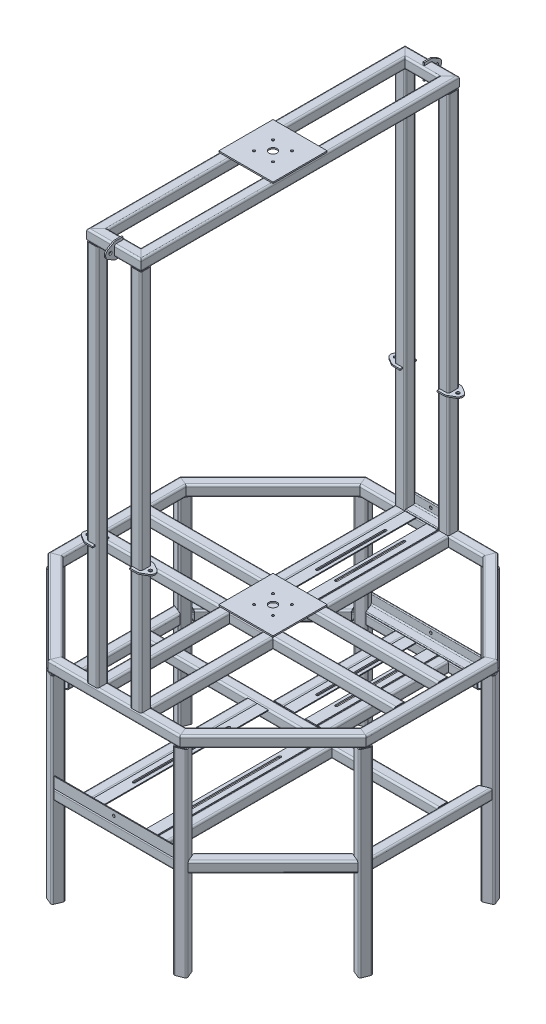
SolidWorks part; units mm, degrees
other "Markup1"
sketch "Sketch22" plane through (591.5094, 1475, 615.7908) normal (0.2707, 0.9524, 0.1401) x (0.5233, -0.0234, -0.8518)
ref_plane "Front Plane" through (0, 0, 0) normal (0, 0, 1) x (1, 0, 0)
ref_plane "Top Plane" through (0, 0, 0) normal (0, 1, 0) x (1, 0, 0)
ref_plane "Right Plane" through (0, 0, 0) normal (1, 0, 0) x (0, 0, -1)
sketch "Sketch2" plane through (0, 0, 0) normal (0, 1, 0) x (1, 0, 0)
  line L1 (567.3402, 235) -> (235, 567.3402)
  line L2 (235, 567.3402) -> (-235, 567.3402)
  line L3 (-235, 567.3402) -> (-567.3402, 235)
  line L4 (-567.3402, 235) -> (-567.3402, -235)
  line L5 (-567.3402, -235) -> (-235, -567.3402)
  line L6 (-235, -567.3402) -> (235, -567.3402)
  line L7 (235, -567.3402) -> (567.3402, -235)
  line L8 (567.3402, -235) -> (567.3402, 235)
  circle A0 centre (0, 0) radius 567.3402 construction
  dimension "D1" = 470
sketch3d "3DSketch1"
  line L0 (-567.3402, 0, 235) -> (-567.3402, -750, 235)
  line L1 (-235, 0, 567.3402) -> (-235, -750, 567.3402)
  line L2 (235, 0, 567.3402) -> (235, -750, 567.3402)
  line L3 (567.3402, 0, 235) -> (567.3402, -750, 235)
  line L4 (567.3402, 0, -235) -> (567.3402, -750, -235)
  line L5 (235, 0, -567.3402) -> (235, -750, -567.3402)
  line L6 (-235, 0, -567.3402) -> (-235, -750, -567.3402)
  line L7 (-567.3402, 0, -235) -> (-567.3402, -750, -235)
  dimension "D1" = 750
  dimension "D2" = 750
  dimension "D3" = 750
  dimension "D4" = 750
  dimension "D5" = 750
  dimension "D6" = 750
  dimension "D7" = 750
  dimension "D8" = 750
sketch3d "3DSketch3"
  line L0 (235, -400, -567.3402) -> (-235, -400, -567.3402)
  line L1 (235, 0, -567.3402) -> (235, -750, -567.3402) construction
  line L2 (-235, 0, -567.3402) -> (-235, -750, -567.3402) construction
  line L3 (-235, -400, -567.3402) -> (-567.3402, -400, -235)
  line L4 (-567.3402, 0, -235) -> (-567.3402, -750, -235) construction
  line L5 (-567.3402, -400, -235) -> (-567.3402, -400, 235)
  line L6 (-567.3402, 0, 235) -> (-567.3402, -750, 235) construction
  line L7 (-567.3402, -400, 235) -> (-235, -400, 567.3402)
  line L8 (-235, 0, 567.3402) -> (-235, -750, 567.3402) construction
  line L9 (-235, -400, 567.3402) -> (235, -400, 567.3402)
  line L10 (235, 0, 567.3402) -> (235, -750, 567.3402) construction
  line L11 (235, -400, 567.3402) -> (567.3402, -400, 235)
  line L12 (567.3402, 0, 235) -> (567.3402, -750, 235) construction
  line L13 (567.3402, -400, 235) -> (567.3402, -400, -235)
  line L14 (567.3402, 0, -235) -> (567.3402, -750, -235) construction
  line L15 (567.3402, -400, -235) -> (235, -400, -567.3402)
  line L16 (567.3402, 0, 0) -> (-567.3402, 0, 0) construction
  line L17 (567.3402, 0, 235) -> (567.3402, 0, -235) construction
  line L18 (-567.3402, 0, -235) -> (-567.3402, 0, 235) construction
  line L19 (567.3402, 0, 60) -> (-567.3402, 0, 60)
  line L20 (567.3402, 0, -60) -> (-567.3402, 0, -60)
  line L21 (0, 0, 567.3402) -> (0, 0, -567.3402) construction
  line L22 (-235, 0, 567.3402) -> (235, 0, 567.3402) construction
  line L23 (60, 0, -567.3402) -> (60, 0, -60)
  line L24 (235, 0, -567.3402) -> (-235, 0, -567.3402) construction
  line L25 (-60, 0, 567.3402) -> (-60, 0, 60)
  line L27 (-117.5, -400, -60) -> (-117.5, -400, 567.3402)
  line L28 (-60, -400, -60) -> (-60, -400, -567.3402)
  line L29 (117.5, -400, -60) -> (117.5, -400, 567.3402)
  line L30 (-235, -380, 567.3402) -> (235, -380, 567.3402)
  line L31 (567.3402, -400, -60) -> (-567.3402, -400, -60)
  line L32 (60, -400, -60) -> (60, -400, -567.3402)
  line L33 (-60, 0, -60) -> (-60, 0, -567.3402)
  line L34 (60, 0, 60) -> (60, 0, 567.3402)
  point P59 (0, -400, 567.3402)
  point P60 (0, -400, -60)
sketch3d "3DSketch6"
  line L0 (60, 0, -567.3402) -> (60, 1450, -567.3402)
  line L1 (-60, 0, -567.3402) -> (-60, 1450, -567.3402)
  line L2 (60, 0, 567.3402) -> (60, 1450, 567.3402)
  line L3 (-60, 0, 567.3402) -> (-60, 1450, 567.3402)
  line L4 (60, 1450, -567.3402) -> (60, 1450, 567.3402)
  line L5 (-60, 1450, 567.3402) -> (-60, 1450, -567.3402)
  line L6 (60, 1450, -567.3402) -> (-60, 1450, -567.3402)
  line L7 (-60, 1450, 567.3402) -> (60, 1450, 567.3402)
  line L8 (60, 20, -567.3402) -> (-60, 20, -567.3402)
  dimension "D1" = 1450
  dimension "D2" = 1450
  dimension "D3" = 1450
  dimension "D4" = 1450
  dimension "D5" = 20
other "Tube (square) 40 X 40 X 3.2(13)"
ref_plane "Plane16" through (-235, 0, -567.3402) normal (-0.7071, 0, 0.7071) x (0.7071, 0, 0.7071)
sketch "Sketch1" plane through (-235, 0, -567.3402) normal (-0.7071, 0, 0.7071) x (0.7071, 0, 0.7071)
  line L0 (-13.6, -16.8) -> (13.6, -16.8)
  line L1 (-16.8, -13.6) -> (-16.8, 13.6)
  line L2 (13.6, 16.8) -> (-13.6, 16.8)
  line L3 (16.8, 13.6) -> (16.8, -13.6)
  line L4 (-13.6, -20) -> (13.6, -20)
  line L5 (-20, -13.6) -> (-20, 13.6)
  line L6 (13.6, 20) -> (-13.6, 20)
  line L7 (20, 13.6) -> (20, -13.6)
  line L8 (-20, 0) -> (-16.8, 0) construction
  line L9 (-16.8, 0) -> (16.8, 0) construction
  line L10 (16.8, 0) -> (20, 0) construction
  line L12 (0, 20) -> (0, 16.8) construction
  line L13 (0, 16.8) -> (0, -16.8) construction
  line L14 (0, -16.8) -> (0, -20) construction
  arc A0 (20, 13.6) -> (13.6, 20) centre (13.6, 13.6) ccw
  arc A1 (13.6, -20) -> (20, -13.6) centre (13.6, -13.6) ccw
  arc A2 (-20, -13.6) -> (-13.6, -20) centre (-13.6, -13.6) ccw
  arc A3 (-13.6, 20) -> (-20, 13.6) centre (-13.6, 13.6) ccw
  arc A4 (-13.6, 16.8) -> (-16.8, 13.6) centre (-13.6, 13.6) ccw
  arc A5 (16.8, 13.6) -> (13.6, 16.8) centre (13.6, 13.6) ccw
  arc A6 (13.6, -16.8) -> (16.8, -13.6) centre (13.6, -13.6) ccw
  arc A7 (-16.8, -13.6) -> (-13.6, -16.8) centre (-13.6, -13.6) ccw
  point P2 (-20, 20)
  point P33 (-20, -20)
  point P34 (20, -20)
  point P36 (20, 20)
  point P37 (0, 0)
  dimension "D1" = 6.4
  dimension "Thickness" = 3.2
  dimension "V_leg" = 40
  dimension "H_leg" = 40
sketch "Sketch3" plane through (0, 1470, 0) normal (0, 1, 0) x (1, 0, 0)
  line L1 (-100, 100) -> (100, 100)
  line L2 (-100, 100) -> (-100, -100)
  line L3 (-100, -100) -> (100, -100)
  line L4 (100, 100) -> (100, -100)
  line L5 (0, -100) -> (0, 100) construction
  line L6 (-100, 0) -> (100, 0) construction
  line L8 (-35, -35) -> (35, -35) construction
  line L9 (-35, -35) -> (-35, 35) construction
  line L10 (-35, 35) -> (35, 35) construction
  line L11 (35, -35) -> (35, 35) construction
  line L12 (0, 35) -> (0, -35) construction
  line L13 (-35, 0) -> (35, 0) construction
  circle A0 centre (0, 0) radius 15
  circle A1 centre (-35, 35) radius 4.5
  circle A2 centre (35, 35) radius 4.5
  circle A3 centre (35, -35) radius 4.5
  circle A4 centre (-35, -35) radius 4.5
  point P0 (0, 0)
  dimension "D2" = 9
  dimension "D5" = 30
  dimension "D1" = 200
  dimension "D3" = 70
  dimension "D4" = 70
other "Trim/Extend1"
other "Trim/Extend2"
other "Trim/Extend3"
other "Trim/Extend4"
extrude "Boss-Extrude2" add sketch "Sketch3" along normal blind 5 separate body
sketch "Sketch4" plane through (0, 20, 0) normal (0, 1, 0) x (1, 0, 0)
  line L4 (100, -100) -> (100, 100)
  line L5 (100, 100) -> (-100, 100)
  line L6 (-100, 100) -> (-100, -100)
  line L7 (-100, -100) -> (100, -100)
  line L8 (100, -100) -> (100, 100)
  line L9 (100, 100) -> (-100, 100)
  line L10 (-100, 100) -> (-100, -100)
  line L11 (-100, -100) -> (100, -100)
  circle A0 centre (-35, 35) radius 4.5 construction
  circle A1 centre (-35, -35) radius 4.5 construction
  circle A2 centre (35, -35) radius 4.5 construction
  circle A3 centre (35, 35) radius 4.5 construction
  circle A4 centre (0, 0) radius 15 construction
  circle A5 centre (-35, 35) radius 4.5
  circle A6 centre (-35, -35) radius 4.5
  circle A7 centre (35, -35) radius 4.5
  circle A8 centre (35, 35) radius 4.5
  circle A9 centre (0, 0) radius 15
  dimension "D1" = 0
extrude "Boss-Extrude3" add sketch "Sketch4" along normal blind 5 separate body
other "L angle (equal) 40 X 40 X 5(18)"
ref_plane "Plane17" through (117.5, -380, -60) normal (0, 0, 1) x (-1, 0, 0)
sketch "Sketch11" plane through (117.5, -380, -60) normal (0, 0, 1) x (-1, 0, 0)
  line L0 (0, 40) -> (0, 0)
  line L2 (5, 37) -> (5, 9.5)
  line L3 (9.5, 5) -> (37, 5)
  line L5 (40, 0) -> (0, 0)
  line L6 (40, 2) -> (40, 0)
  line L7 (0, 40) -> (2, 40)
  arc A0 (2, 40) -> (5, 37) centre (2, 37) cw
  arc A1 (40, 2) -> (37, 5) centre (37, 2) ccw
  arc A2 (9.5, 5) -> (5, 9.5) centre (9.5, 9.5) cw
  point P10 (0, 20)
  point P11 (20, 0)
  point P14 (0, 0)
  dimension "Radius_2" = 3
  dimension "Radius_1" = 4.5
  dimension "V_leg" = 40
  dimension "H_leg" = 40
  dimension "thickness" = 5
other "Trim/Extend5"
other "Trim/Extend6"
sketch "Sketch12" plane through (0, -380, 0) normal (0, 1, 0) x (1, 0, 0)
  line L0 (94.25, 60) -> (94.25, -547.3402) construction
  line L1 (108, 60) -> (80.5, 60) construction
  line L2 (80.5, -547.3402) -> (108, -547.3402) construction
  line L3 (94.25, -68.6701) -> (94.25, -418.6701) construction
  line L4 (98.75, -68.6701) -> (98.75, -418.6701)
  line L5 (89.75, -68.6701) -> (89.75, -418.6701)
  line L6 (0, -677.3699) -> (0, 677.3699) construction
  line L7 (-94.25, -68.6701) -> (-94.25, -418.6701) construction
  line L8 (-98.75, -68.6701) -> (-98.75, -418.6701)
  line L9 (-89.75, -68.6701) -> (-89.75, -418.6701)
  arc A0 (98.75, -68.6701) -> (89.75, -68.6701) centre (94.25, -68.6701) ccw
  arc A1 (89.75, -418.6701) -> (98.75, -418.6701) centre (94.25, -418.6701) ccw
  arc A2 (-98.75, -68.6701) -> (-89.75, -68.6701) centre (-94.25, -68.6701) cw
  arc A3 (-89.75, -418.6701) -> (-98.75, -418.6701) centre (-94.25, -418.6701) cw
  point P8 (94.25, -243.6701)
  point P17 (-94.25, -243.6701)
  dimension "D1" = 4.5
  dimension "D2" = 350
extrude "Cut-Extrude1" cut sketch "Sketch12" against normal blind 5
sketch "Sketch13" plane through (0, -380, 0) normal (0, 1, 0) x (1, 0, 0)
  line L0 (-35, 547.3402) -> (-35, 100) construction
  line L3 (-35, 448.6701) -> (-35, 198.6701) construction
  line L4 (-30.5, 448.6701) -> (-30.5, 198.6701)
  line L5 (-39.5, 448.6701) -> (-39.5, 198.6701)
  line L6 (0, -677.3699) -> (0, 677.3699) construction
  line L7 (35, 448.6701) -> (35, 198.6701) construction
  line L8 (30.5, 448.6701) -> (30.5, 198.6701)
  line L9 (39.5, 448.6701) -> (39.5, 198.6701)
  line L10 (-60, 100) -> (-20, 100) construction
  line L11 (-60, 547.3402) -> (-20, 547.3402) construction
  arc A0 (-30.5, 448.6701) -> (-39.5, 448.6701) centre (-35, 448.6701) ccw
  arc A1 (-39.5, 198.6701) -> (-30.5, 198.6701) centre (-35, 198.6701) ccw
  arc A2 (30.5, 448.6701) -> (39.5, 448.6701) centre (35, 448.6701) cw
  arc A3 (39.5, 198.6701) -> (30.5, 198.6701) centre (35, 198.6701) cw
  point P8 (-35, 323.6701)
  point P17 (35, 323.6701)
  dimension "D2" = 4.5
  dimension "D1" = 250
  dimension "D3" = 35
other "L angle (equal) 40 X 40 X 5(21)"
ref_plane "Plane18" through (-235, -380, 587.3402) normal (1, 0, 0) x (0, 0, -1)
sketch "Sketch14" plane through (-235, -380, 587.3402) normal (1, 0, 0) x (0, 0, -1)
  line L0 (0, 40) -> (0, 0)
  line L2 (5, 37) -> (5, 9.5)
  line L3 (9.5, 5) -> (37, 5)
  line L5 (40, 0) -> (0, 0)
  line L6 (40, 2) -> (40, 0)
  line L7 (0, 40) -> (2, 40)
  arc A0 (2, 40) -> (5, 37) centre (2, 37) cw
  arc A1 (40, 2) -> (37, 5) centre (37, 2) ccw
  arc A2 (9.5, 5) -> (5, 9.5) centre (9.5, 9.5) cw
  point P10 (0, 20)
  point P11 (20, 0)
  point P14 (0, 0)
  dimension "Radius_2" = 3
  dimension "Radius_1" = 4.5
  dimension "V_leg" = 40
  dimension "H_leg" = 40
  dimension "thickness" = 5
other "Trim/Extend7"
sketch "Sketch15" plane through (0, 0, 587.3402) normal (0, 0, 1) x (1, 0, 0)
  line L0 (221.6364, -380) -> (-221.6364, -380) construction
  line L3 (0, -340) -> (0, -380) construction
  line L4 (221.6364, -340) -> (-221.6364, -340) construction
  line L5 (-235, -380) -> (235, -380) construction
  circle A0 centre (0, -356.5) radius 5
  dimension "D1" = 10
  dimension "D2" = 23.5
extrude "Cut-Extrude3" cut sketch "Sketch15" against normal blind 5
mirror "Mirror1" about plane through (0, 0, 0) normal (0, 0, 1)
other "Trim/Extend8"
other "L angle (equal) 40 X 40 X 5(20)"
ref_plane "Plane19" through (60, 20, -587.3402) normal (-1, 0, 0) x (0, 0, 1)
sketch "Sketch19" plane through (60, 20, -587.3402) normal (-1, 0, 0) x (0, 0, 1)
  line L0 (0, 40) -> (0, 0)
  line L2 (5, 37) -> (5, 9.5)
  line L3 (9.5, 5) -> (37, 5)
  line L5 (40, 0) -> (0, 0)
  line L6 (40, 2) -> (40, 0)
  line L7 (0, 40) -> (2, 40)
  arc A0 (2, 40) -> (5, 37) centre (2, 37) cw
  arc A1 (40, 2) -> (37, 5) centre (37, 2) ccw
  arc A2 (9.5, 5) -> (5, 9.5) centre (9.5, 9.5) cw
  point P10 (0, 20)
  point P11 (20, 0)
  point P14 (0, 0)
  dimension "Radius_2" = 3
  dimension "Radius_1" = 4.5
  dimension "V_leg" = 40
  dimension "H_leg" = 40
  dimension "thickness" = 5
sketch "Sketch20" plane through (0, 0, -587.3402) normal (0, 0, -1) x (-1, 0, 0)
  line L0 (0, 60) -> (0, 20) construction
  line L1 (60, 60) -> (-60, 60) construction
  line L2 (60, 20) -> (-60, 20) construction
  circle A0 centre (0, 43.5) radius 5.1
  dimension "D1" = 10.2
  dimension "D2" = 23.5
extrude "Cut-Extrude5" cut sketch "Sketch20" against normal up to next
ref_plane "Plane20" through (0, 0, 0) normal (1, 0, 0) x (0, 0, -1)
sketch "Sketch21" plane through (0, 0, 0) normal (1, 0, 0) x (0, 0, -1)
  line L0 (587.3402, 1436.4) -> (587.3402, 1463.6) construction
  line L1 (587.3402, 1436.4) -> (587.3402, 1463.6)
  line L2 (580.9402, 1470) -> (555.9402, 1470)
  line L3 (-580.9402, 1470) -> (580.9402, 1470) construction
  line L4 (555.9402, 1470) -> (555.9402, 1480)
  line L5 (555.9402, 1480) -> (580.5812, 1480)
  line L6 (590.5812, 1477.3205) -> (611.2306, 1465.3986)
  line L7 (587.3402, 1450) -> (593.8896, 1450) construction
  line L8 (590.5812, 1422.6795) -> (611.2306, 1434.6014)
  line L9 (555.9402, 1420) -> (580.5812, 1420)
  line L10 (555.9402, 1430) -> (555.9402, 1420)
  line L11 (580.9402, 1430) -> (555.9402, 1430)
  arc A0 (580.9402, 1430) -> (587.3402, 1436.4) centre (580.9402, 1436.4) ccw construction
  arc A1 (587.3402, 1463.6) -> (580.9402, 1470) centre (580.9402, 1463.6) ccw construction
  arc A2 (580.9402, 1430) -> (587.3402, 1436.4) centre (580.9402, 1436.4) ccw
  arc A3 (587.3402, 1463.6) -> (580.9402, 1470) centre (580.9402, 1463.6) ccw
  arc A4 (611.2306, 1434.6014) -> (611.2306, 1465.3986) centre (602.3402, 1450) ccw
  circle A5 centre (602.3402, 1450) radius 6
  arc A6 (590.5812, 1422.6795) -> (580.5812, 1420) centre (580.5812, 1440) cw
  arc A7 (590.5812, 1477.3205) -> (580.5812, 1480) centre (580.5812, 1460) ccw
  point P14 (587.3402, 1450)
  point P22 (585.9402, 1420)
  point P26 (585.9402, 1480)
  dimension "D2" = 10
  dimension "D7" = 12
  dimension "D8" = 20
  dimension "D1" = 25
  dimension "D3" = 30
  dimension "D4" = 15
  dimension "D5" = 30
  dimension "D6" = 30
extrude "Boss-Extrude4" add sketch "Sketch21" along normal mid plane 5 separate body
move or copy body "Body-Move/Copy4" bodies to move or copy 438 copy yes number of copies 1 translate (0, 0, -97.3114)
move or copy body "Body-Move/Copy6" bodies to move or copy 449 placed by mates yes
other "Distance3" parameters "D1"=450
mirror "Mirror4" about plane through (0, 0, 0) normal (1, 0, 0)
mirror "Mirror5" about plane through (0, 0, 0) normal (0, 0, 1)
extrude "Cut-Extrude6" cut sketch "Sketch13" against normal through all both and the other way through all
other "Trim/Extend9"
other "Trim/Extend10"
other "Trim/Extend11"
equation "\"D7@3DSketch3\"=\"D6@3DSketch3\""
equation "\"D1@3DSketch3\"=\"D6@3DSketch3\""
equation "\"D2@3DSketch3\"=\"D6@3DSketch3\""
equation "\"D5@3DSketch3\"=\"D6@3DSketch3\""
equation "\"D4@3DSketch3\"=\"D6@3DSketch3\""
equation "\"D3@3DSketch3\"=\"D6@3DSketch3\""
